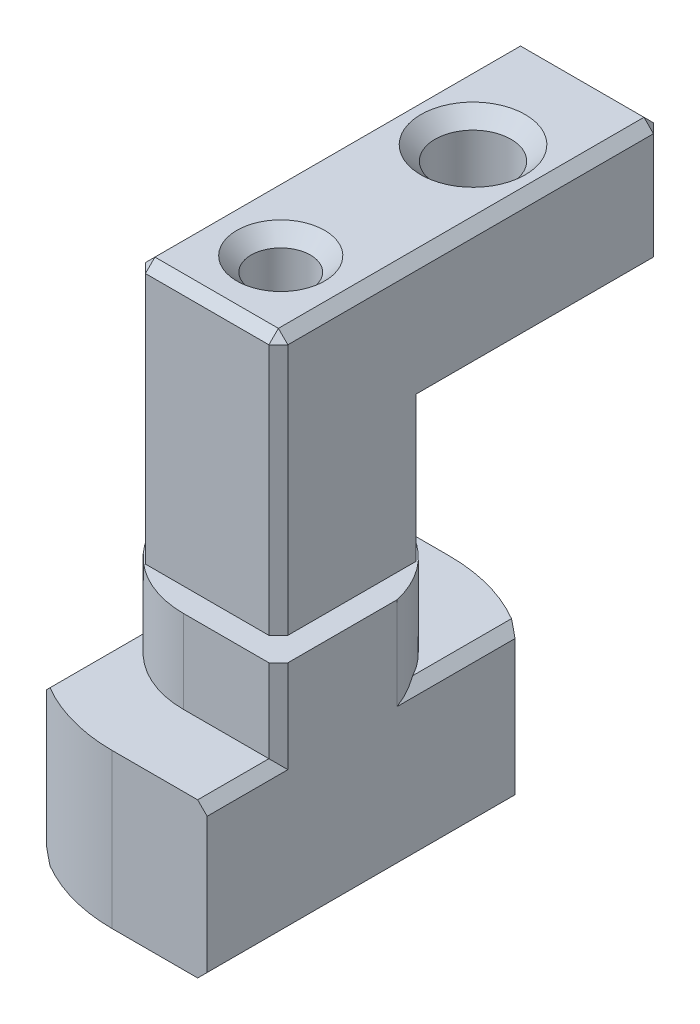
SolidWorks part; units mm, degrees
ref_plane "前基準面" through (0, 0, 0) normal (0, 0, 1) x (1, 0, 0)
ref_plane "上基準面" through (0, 0, 0) normal (0, 1, 0) x (1, 0, 0)
ref_plane "右基準面" through (0, 0, 0) normal (1, 0, 0) x (0, 0, -1)
sketch "草圖2" plane through (0, 0, 0) normal (0, 1, 0) x (1, 0, 0)
  line L4 (4, -7.1) -> (4, 5.866)
  line L9 (0, 7.1) -> (-4, 7.1)
  line L10 (-4, 7.1) -> (-4, -5.866)
  line L11 (0, -7.1) -> (4, -7.1)
  arc A3 (4, 5.866) -> (0, 7.1) centre (0, 0) ccw
  arc A4 (-4, -5.866) -> (0, -7.1) centre (0, 0) ccw
  point P15 (2, -7.1)
  dimension "D1" = 8
  dimension "D3" = 7.1
  dimension "D5" = 7.1
  dimension "D2" = 14.2
  dimension "D4" = 4
extrude "填料-伸長1" add sketch "草圖2" along normal blind 6.5 contours L11 L4 A3 L9 L10 A4
sketch "草圖3" plane through (0, 6.5, 0) normal (0, 1, 0) x (1, 0, 0)
  line L1 (-4, -0.9) -> (-4, 4.1)
  line L6 (-4, 4.1) -> (0, 4.1)
  line L8 (4, 0.9) -> (4, -4.1)
  line L9 (4, -4.1) -> (0, -4.1)
  arc A0 (0, 4.1) -> (4, 0.9) centre (0, 0) cw
  arc A1 (0, -4.1) -> (-4, -0.9) centre (0, 0) cw
  dimension "D9" = 4.1
  dimension "D10" = 4.1
  dimension "D5" = 8.2
  dimension "D6" = 4.1
  dimension "D7" = 8
  dimension "D8" = 4
extrude "填料-伸長2" add sketch "草圖3" along normal blind 3.5
sketch "草圖10" plane through (0, 10, 0) normal (0, 1, 0) x (1, 0, 0)
  line L0 (-3, 3.1) -> (3, 3.1)
  line L1 (3, 3.1) -> (3, -3.1)
  line L2 (3, -3.1) -> (-3, -3.1)
  line L3 (-3, -3.1) -> (-3, 3.1)
  dimension "D1" = 6
  dimension "D2" = 6.2
extrude "填料-伸長4" add sketch "草圖10" along normal blind 5.7
sketch "草圖4" plane through (0, 15.7, 0) normal (0, 1, 0) x (1, 0, 0)
  line L0 (-3, -3.1) -> (3, -3.1) construction
  line L1 (-3, -3.1) -> (3, -3.1)
  line L2 (-3, -3.1) -> (-3, 13.1)
  line L3 (-3, 13.1) -> (3, 13.1)
  line L4 (3, 13.1) -> (3, -3.1)
  dimension "D1" = 16.2
  dimension "D2" = 6
extrude "填料-伸長3" add sketch "草圖4" along normal blind 5.3
sketch "草圖6" plane through (0, 21, 0) normal (0, 1, 0) x (1, 0, 0)
  circle A0 centre (0, 0) radius 1.25
  dimension "D1" = 2.5
extrude "除料-伸長1" cut sketch "草圖6" against normal blind 17
sketch "草圖8" plane through (0, 0, 0) normal (0, -1, 0) x (1, 0, 0)
  circle A0 centre (0, 0) radius 1.9
  dimension "D1" = 3.8
extrude "除料-伸長2" cut sketch "草圖8" against normal blind 4
sketch "草圖9" plane through (0, 21, 0) normal (0, 1, 0) x (1, 0, 0)
  line L4 (3, 13.1) -> (-3, 13.1) construction
  line L5 (-3, 13.1) -> (-3, -3.1) construction
  circle A0 centre (0, 8.1) radius 1.6
  dimension "D1" = 3.2
  dimension "D2" = 5
  dimension "D3" = 3
extrude "除料-伸長3" cut sketch "草圖9" against normal up to next
chamfer "導角1" distance 0.4 angle 45 21 edges at (4, 0, 0.617) (-4, 0, -0.617) (4, 6.5, -3.383) (4, 6.5, 5.6) (-4, 6.5, 3.383) (-4, 6.5, -5.6) (3, 15.5, 3.1) (-3, 12.85, -3.1) (4, 8.25, 4.1) (-4, 8.25, -4.1) (3, 12.85, -3.1) (3, 15.7, -8.1) (-3, 18.35, -13.1) (0, 21, -13.1) (-3, 21, -5) (-3, 15.5, 3.1) (0, 21, 3.1) (3, 21, -5) (3, 18.35, -13.1) (0, 15.7, -13.1) (-3, 15.7, -8.1)
chamfer "導角3" distance 0.6 angle 45 3 edges at (0, 21, 1.25) (0, 21, -6.5) (0, 0, -1.9)
thread "螺紋2" pitch 0.7 start angle 0, offset 0, length 0, pitch 0.7, diameter 4
ref_plane "平面2" through (2, 0.6, 0) normal (0, 0, 1) x (1, 0, 0)
sketch "螺紋輪廓2" plane through (2, 0.6, 0) normal (0, 0, 1) x (1, 0, 0)
  line L0 (0, 0) -> (0, 0.7) construction
  line L11 (0, 0) -> (0, 0.6125)
  line L12 (0, 0.6125) -> (-0.3789, 0.3937)
  line L13 (-0.3789, 0.3937) -> (-0.3789, 0.2187)
  line L15 (-0.3789, 0.2187) -> (0, 0)
  line L17 (-0.3789, 0.3062) -> (0, 0.3062) construction
  point P2 (0, 0)
  dimension "Pitch" = 0.7
  dimension "Profile_Angle" = 60
  dimension "Profile_Land" = 0.175
  dimension "Profile_Height" = 0.3789
